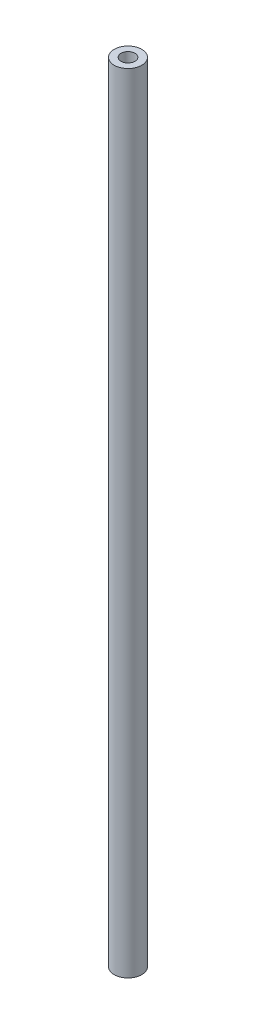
SolidWorks part; units mm, degrees
ref_plane "Front Plane" through (0, 0, 0) normal (0, 0, 1) x (1, 0, 0)
ref_plane "Top Plane" through (0, 0, 0) normal (0, 1, 0) x (1, 0, 0)
ref_plane "Right Plane" through (0, 0, 0) normal (1, 0, 0) x (0, 0, -1)
sketch "Sketch1" plane through (0, 0, 0) normal (0, 1, 0) x (1, 0, 0)
  circle A0 centre (0, 0) radius 4.7625
  circle A1 centre (0, 0) radius 1.0795
  dimension "D1" = 3.683
  dimension "D2" = 9.525
extrude "Boss-Extrude1" add sketch "Sketch1" along normal blind 271.78
hole_wizard "#10-32 Tapped Hole1" positions "Sketch3" profile "Sketch2" tap size "#10-32" standard "ANSI Inch"
sketch "Sketch3" plane through (0, 0, 0) normal (0, -1, 0) x (-1, 0, 0)
  point P0 (0, 0)
sketch "Sketch2" plane through (0, 0, 0) normal (1, 0, 0) x (0, 0, -1)
  line L0 (0, 0) -> (0, 32.9633)
  line L1 (0, 32.9633) -> (2.0193, 31.75)
  line L2 (2.0193, 31.75) -> (2.0193, 25.4)
  line L3 (2.0193, 25.4) -> (2.413, 25.4)
  line L4 (2.413, 25.4) -> (2.413, 0)
  line L5 (2.413, 0) -> (0, 0)
  line L10 (0, 32.9633) -> (-2.0193, 31.75) construction
  line L11 (0, -6.35) -> (0, 107.95) construction
  dimension "Tap Drill Dia." = 4.0386
  dimension "Tap Drill Depth" = 31.75
  dimension "Thread Major Dia." = 4.826
  dimension "Thread Depth" = 25.4
  dimension "Drill Angle" = 118
hole_wizard "#10-32 Tapped Hole2" positions "Sketch5" profile "Sketch4" tap size "#10-32" standard "ANSI Inch"
sketch "Sketch5" plane through (0, 271.78, 0) normal (0, 1, 0) x (1, 0, 0)
  point P0 (0, 0)
sketch "Sketch4" plane through (0, 271.78, 0) normal (1, 0, 0) x (0, 0, 1)
  line L0 (0, 0) -> (0, 32.9633)
  line L1 (0, 32.9633) -> (2.0193, 31.75)
  line L2 (2.0193, 31.75) -> (2.0193, 25.4)
  line L3 (2.0193, 25.4) -> (2.413, 25.4)
  line L4 (2.413, 25.4) -> (2.413, 0)
  line L5 (2.413, 0) -> (0, 0)
  line L10 (0, 32.9633) -> (-2.0193, 31.75) construction
  line L11 (0, -6.35) -> (0, 107.95) construction
  dimension "Tap Drill Dia." = 4.0386
  dimension "Tap Drill Depth" = 31.75
  dimension "Thread Major Dia." = 4.826
  dimension "Thread Depth" = 25.4
  dimension "Drill Angle" = 118
